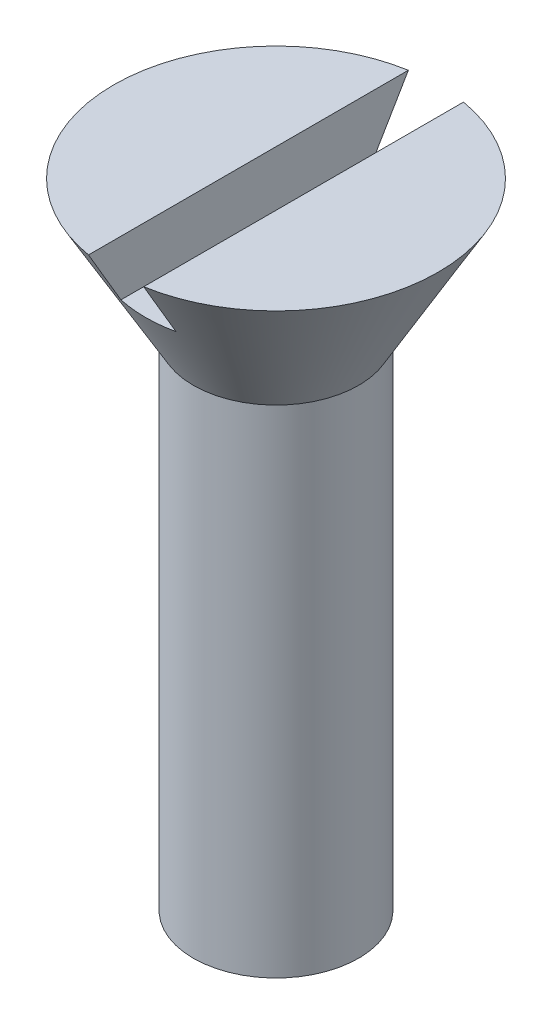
SolidWorks part; units mm, degrees
ref_plane "Front Plane" through (0, 0, 0) normal (0, 0, 1) x (1, 0, 0)
ref_plane "Top Plane" through (0, 0, 0) normal (0, 1, 0) x (1, 0, 0)
ref_plane "Right Plane" through (0, 0, 0) normal (1, 0, 0) x (0, 0, -1)
sketch "Sketch1" plane through (0, 0, 0) normal (0, 0, 1) x (1, 0, 0)
  line L0 (0, 0) -> (0, 24.7321)
  line L1 (0, 24.7321) -> (5.8868, 24.7321)
  line L2 (5.8868, 24.7321) -> (3, 19.7321)
  line L3 (3, 19.7321) -> (3, 1.7321)
  line L4 (3, 1.7321) -> (0, 0)
  line L5 (0, 30.1235) -> (0, -5.1382) construction
  line L7 (-5.8868, 24.7321) -> (-3, 19.7321) construction
  line L8 (0, 0) -> (-3.2389, -1.87) construction
  line L9 (0, 0) -> (2.1344, -1.2323) construction
  dimension "D1" = 6
  dimension "D2" = 18
  dimension "D3" = 5
  dimension "D4" = 60
  dimension "D5" = 120
revolve "Revolve1" add sketch "Sketch1" angle 360 about L5
sketch "Sketch2" plane through (0, 0, 0) normal (0, 0, 1) x (1, 0, 0)
  line L0 (0, -0.9967) -> (0, 26.645) construction
  line L1 (5.8868, 24.7321) -> (-5.8868, 24.7321) construction
  line L2 (-1, 24.7321) -> (1, 24.7321)
  line L3 (-1, 24.7321) -> (-1, 22.7321)
  line L4 (-1, 22.7321) -> (1, 22.7321)
  line L5 (1, 24.7321) -> (1, 22.7321)
  dimension "D1" = 2
  dimension "D2" = 2
extrude "Cut-Extrude2" cut sketch "Sketch2" against normal mid plane 12
